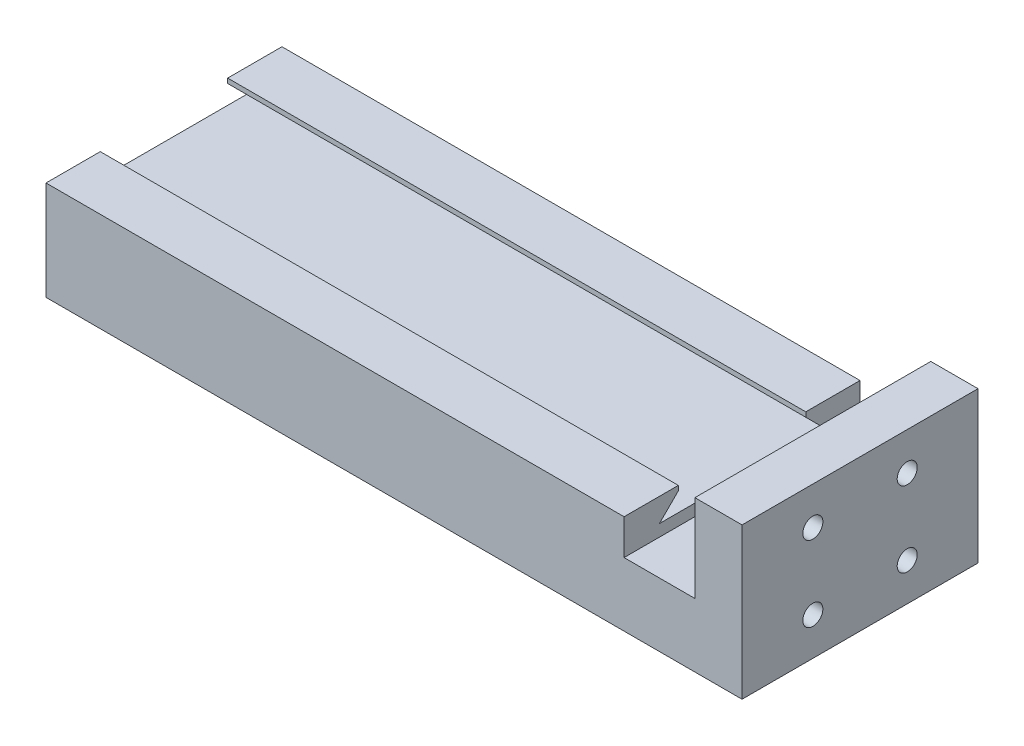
SolidWorks part; units mm, degrees
ref_plane "Front Plane" through (0, 0, 0) normal (0, 0, 1) x (1, 0, 0)
ref_plane "Top Plane" through (0, 0, 0) normal (0, 1, 0) x (1, 0, 0)
ref_plane "Right Plane" through (0, 0, 0) normal (1, 0, 0) x (0, 0, -1)
sketch "Sketch1" plane through (0, 0, 0) normal (0, 0, 1) x (1, 0, 0)
  line L0 (-147.5, 0) -> (147.5, 0)
  line L1 (-147.5, 0) -> (-147.5, 42)
  line L2 (97.5, 42) -> (-147.5, 42)
  line L3 (147.5, 0) -> (147.5, 64)
  line L4 (97.5, 42) -> (97.5, 27)
  line L5 (147.5, 64) -> (127.5, 64)
  line L6 (127.5, 27) -> (127.5, 64)
  line L7 (97.5, 27) -> (127.5, 27)
  dimension "D1" = 295
  dimension "D2" = 42
  dimension "D3" = 64
  dimension "D4" = 20
  dimension "D5" = 147.5
  dimension "D6" = 27
  dimension "D7" = 30
extrude "Boss-Extrude1" add sketch "Sketch1" along normal mid plane 100
sketch "Sketch2" plane through (-147.5, 0, 0) normal (-1, 0, 0) x (0, 0, 1)
  line L0 (-50, 42) -> (-27, 42)
  line L1 (50, 42) -> (27, 42)
  line L2 (-27, 42) -> (-27, 40)
  line L3 (27, 42) -> (27, 40)
  line L4 (-27, 40) -> (-35, 32)
  line L5 (-35, 32) -> (35, 32)
  line L6 (27, 40) -> (35, 32)
  line L7 (-50, 42) -> (-50, 0) construction
  line L8 (50, 42) -> (50, 52)
  line L9 (50, 52) -> (-50, 52)
  line L10 (-50, 52) -> (-50, 42)
  line L11 (50, 42) -> (-50, 42) construction
  dimension "D1" = 2
  dimension "D2" = 70
  dimension "D3" = 45
  dimension "D4" = 23
  dimension "D5" = 10
  dimension "D6" = 54
  dimension "D7" = 10
  dimension "D8" = 45
extrude "Cut-Extrude1" cut sketch "Sketch2" against normal up to surface (245 mm away)
hole_wizard "M10x1.5 Tapped Hole1" positions "Sketch4" profile "Sketch3" tap size "M10x1.5" standard "ANSI Metric"
sketch "Sketch4" plane through (147.5, 0, 0) normal (1, 0, 0) x (0, 0, -1)
  line L0 (0, 0) -> (0, 50.1716) construction
  line L2 (-50, 0) -> (50, 0) construction
  point P0 (-20, 48)
  point P2 (20, 48)
  point P4 (20, 16)
  point P6 (-20, 16)
  dimension "D1" = 40
  dimension "D2" = 32
  dimension "D3" = 16
sketch "Sketch3" plane through (147.5, 48, 20) normal (0, 1, 0) x (0, 0, -1)
  line L0 (0, 0) -> (0, 27.0537)
  line L1 (0, 27.0537) -> (4.25, 24.5)
  line L2 (4.25, 24.5) -> (4.25, 0)
  line L5 (4.25, 0) -> (0, 0)
  line L10 (0, 27.0537) -> (-4.25, 24.5) construction
  line L11 (0, -6.35) -> (0, 107.95) construction
  dimension "Tap Drill Dia." = 8.5
  dimension "Tap Drill Depth" = 24.5
  dimension "Drill Angle" = 118
